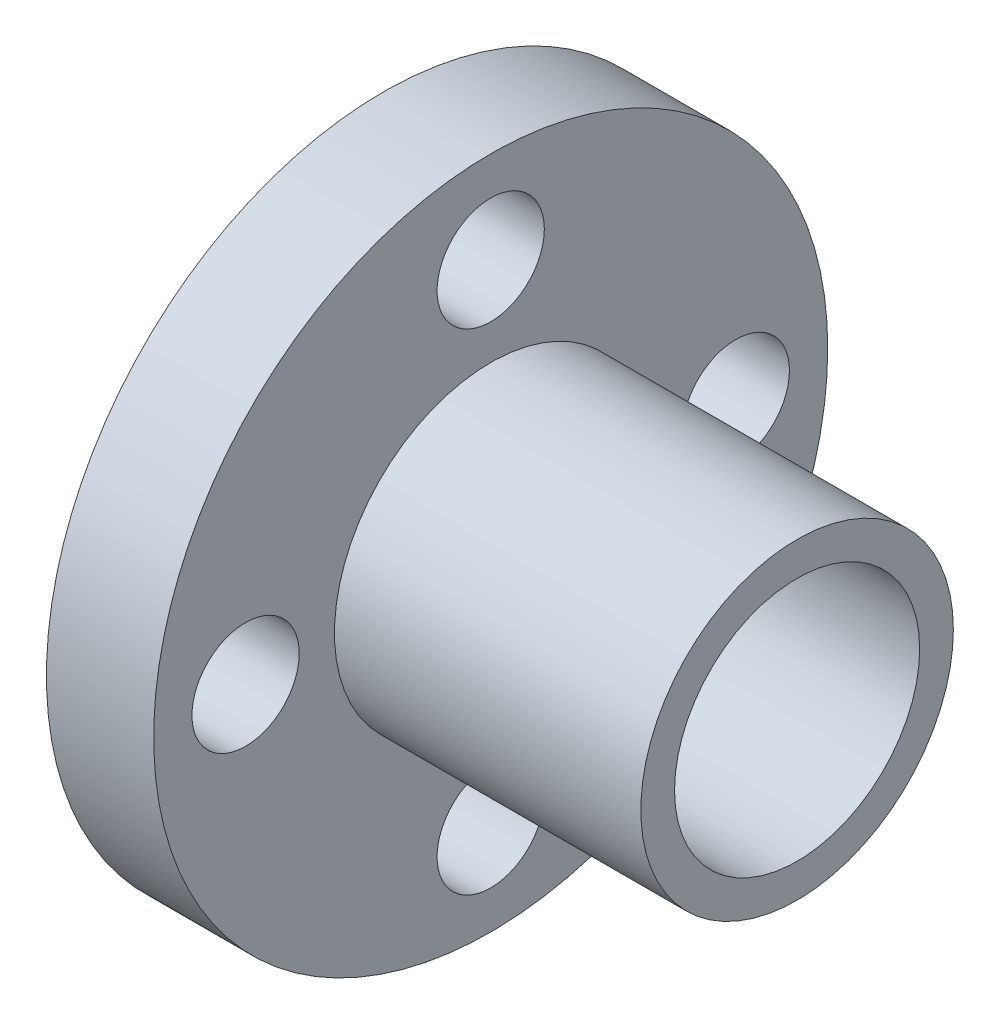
SolidWorks part; units mm, degrees
ref_plane "Front Plane" through (0, 0, 0) normal (0, 0, 1) x (1, 0, 0)
ref_plane "Top Plane" through (0, 0, 0) normal (0, 1, 0) x (1, 0, 0)
ref_plane "Right Plane" through (0, 0, 0) normal (1, 0, 0) x (0, 0, -1)
sketch "Sketch1" plane through (0, 0, 0) normal (1, 0, 0) x (0, 0, -1)
  line L0 (0, 0) -> (0, 8) construction
  line L1 (0, 0) -> (8, 0) construction
  line L2 (0, 0) -> (0, -8) construction
  line L3 (0, 0) -> (-8, 0) construction
  circle A7 centre (0, 0) radius 11
  circle A8 centre (0, 0) radius 5.1
  circle A9 centre (0, 8) radius 1.75
  circle A10 centre (8, 0) radius 1.75
  circle A11 centre (0, -8) radius 1.75
  circle A12 centre (-8, 0) radius 1.75
  point P18 (0, 0)
  dimension "D1" = 22
  dimension "D2" = 10.2
  dimension "D3" = 3.5
  dimension "D4" = 8
extrude "Boss-Extrude1" add sketch "Sketch1" along normal blind 3.5
sketch "Sketch2" plane through (3.5, 0, 0) normal (1, 0, 0) x (0, 0, -1)
  circle A0 centre (0, 0) radius 5.1
  circle A1 centre (0, 0) radius 4
  dimension "D1" = 10.2
  dimension "D2" = 8
extrude "Boss-Extrude2" add sketch "Sketch2" along normal blind 10 and the other way blind 5
